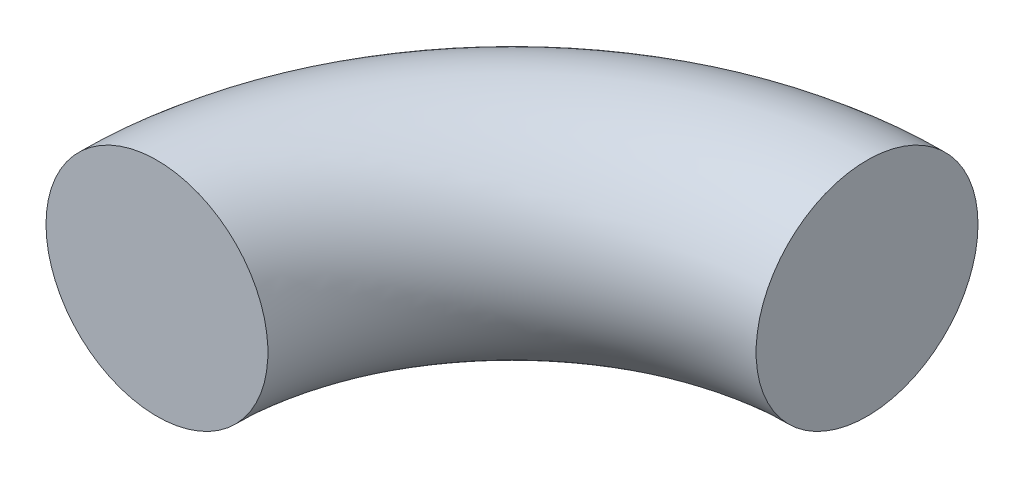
SolidWorks part; units mm, degrees
ref_plane "Front Plane" through (0, 0, 0) normal (0, 0, 1) x (1, 0, 0)
ref_plane "Top Plane" through (0, 0, 0) normal (0, 1, 0) x (1, 0, 0)
ref_plane "Right Plane" through (0, 0, 0) normal (1, 0, 0) x (0, 0, -1)
sketch "Sketch1" plane through (0, 0, 0) normal (0, 0, 1) x (1, 0, 0)
  line L0 (-23.5841, 17.348) -> (-23.5841, 8.3912) construction
  circle A0 centre (-26.1241, 12.6399) radius 0.7937
  dimension "D1" = 1.5875
  dimension "D2" = 2.54
revolve "Revolve1" add sketch "Sketch1" angle 90 about L0
